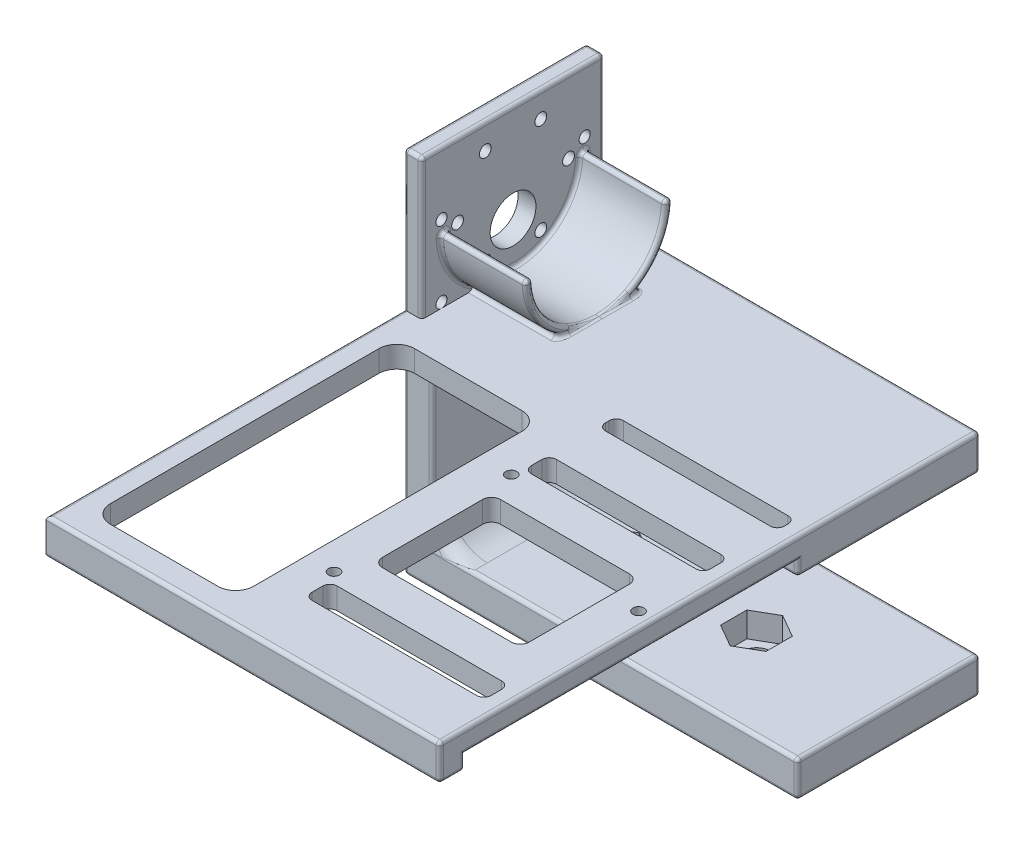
SolidWorks part; units mm, degrees
ref_plane "Front Plane" through (0, 0, 0) normal (0, 0, 1) x (1, 0, 0)
ref_plane "Top Plane" through (0, 0, 0) normal (0, 1, 0) x (1, 0, 0)
ref_plane "Right Plane" through (0, 0, 0) normal (1, 0, 0) x (0, 0, -1)
sketch "Sketch1" plane through (0, 0, 0) normal (0, 0, 1) x (1, 0, 0)
  line L1 (0, 0) -> (8, 0)
  line L2 (0, 0) -> (0, 118)
  line L3 (0, 118) -> (8, 118)
  line L4 (8, 0) -> (8, 118)
  line L5 (4, 118) -> (4, 0) construction
  line L6 (0, 59) -> (8, 59) construction
  line L7 (8, 0) -> (110, 0)
  line L9 (8, 10) -> (110, 10)
  line L10 (110, 0) -> (110, 10)
  line L11 (59, 10) -> (59, 0) construction
  line L12 (3, 5) -> (110, 5) construction
  line L13 (8, 54) -> (110, 54)
  line L15 (8, 64) -> (110, 64)
  line L16 (110, 54) -> (110, 64)
  line L17 (59, 64) -> (59, 54) construction
  line L18 (8, 59) -> (110, 59) construction
  point P99 (59, 5)
  point P128 (59, 59)
  point P236 (4, 59)
extrude "Boss-Extrude1" add sketch "Sketch1" along normal blind 51 contours L13 L16 L15 L4 | L7 L10 L9 L4 | L1 L4 L3 L2
sketch "Sketch2" plane through (8, 0, 0) normal (1, 0, 0) x (0, 0, -1)
  line L0 (-51, 64) -> (0, 64) construction
  line L1 (-51, 64) -> (0, 64) construction
  line L2 (-46, 82.5) -> (-44, 82.5)
  line L3 (-7, 82.5) -> (-5, 82.5)
  arc A0 (-44, 82.5) -> (-7, 82.5) centre (-25.5, 82.5) ccw
  arc A1 (-46, 82.5) -> (-5, 82.5) centre (-25.5, 82.5) ccw
  circle A2 centre (-25.5, 82.5) radius 20.5 construction
  circle A3 centre (-25.5, 82.5) radius 18.5 construction
  point P5 (-25.5, 64)
  dimension "D1" = 37
  dimension "D2" = 2
extrude "Boss-Extrude2" add sketch "Sketch2" along normal blind 21 contours L2 A1 A0 M7
sketch "Sketch3" plane through (0, 0, 0) normal (-1, 0, 0) x (0, 0, 1)
  circle A0 centre (41, 82.5) radius 1.25 construction
  circle A1 centre (33.25, 69.0766) radius 1.25 construction
  circle A2 centre (25.5, 75.5) radius 6 construction
  circle A3 centre (17.75, 69.0766) radius 1.25 construction
  circle A4 centre (10, 82.5) radius 1.25 construction
  circle A5 centre (33.25, 95.9234) radius 1.25 construction
  circle A6 centre (17.75, 95.9234) radius 1.25 construction
  circle A7 centre (41, 82.5) radius 1.25 construction
  circle A8 centre (33.25, 69.0766) radius 1.25 construction
  circle A9 centre (25.5, 75.5) radius 6 construction
  circle A10 centre (17.75, 69.0766) radius 1.25 construction
  circle A11 centre (10, 82.5) radius 1.25 construction
  circle A12 centre (33.25, 95.9234) radius 1.25 construction
  circle A13 centre (17.75, 95.9234) radius 1.25 construction
  circle A14 centre (41, 82.5) radius 1.65
  circle A15 centre (33.25, 69.0766) radius 1.65
  circle A16 centre (25.5, 75.5) radius 6.4
  circle A17 centre (17.75, 69.0766) radius 1.65
  circle A18 centre (10, 82.5) radius 1.65
  circle A19 centre (33.25, 95.9234) radius 1.65
  circle A20 centre (17.75, 95.9234) radius 1.65
  dimension "D1" = 0.4
extrude "Cut-Extrude1" cut sketch "Sketch3" against normal through all
sketch "Sketch4" plane through (0, 10, 0) normal (0, 1, 0) x (1, 0, 0)
  line L1 (39.35, -29.1662) -> (39.35, -21.8338)
  line L2 (39.35, -21.8338) -> (33, -18.1677)
  line L3 (33, -18.1677) -> (26.65, -21.8338)
  line L4 (110, 0) -> (8, 0)
  line L5 (8, 0) -> (8, -51)
  line L6 (8, -51) -> (110, -51)
  line L7 (110, -51) -> (110, 0)
  line L8 (110, 0) -> (8, 0) construction
  line L9 (8, 0) -> (8, -51) construction
  line L10 (8, -51) -> (110, -51) construction
  line L11 (110, -51) -> (110, 0) construction
  line L12 (26.65, -21.8338) -> (26.65, -29.1662)
  line L13 (26.65, -29.1662) -> (33, -32.8323)
  line L14 (33, -32.8323) -> (39.35, -29.1662)
  line L15 (79.35, -29.1662) -> (79.35, -21.8338)
  line L16 (79.35, -21.8338) -> (73, -18.1677)
  line L17 (73, -18.1677) -> (66.65, -21.8338)
  line L18 (66.65, -21.8338) -> (66.65, -29.1662)
  line L19 (66.65, -29.1662) -> (73, -32.8323)
  line L20 (73, -32.8323) -> (79.35, -29.1662)
  circle A0 centre (33, -25.5) radius 6.35 construction
  circle A1 centre (73, -25.5) radius 6.35 construction
  point P21 (8, -25.5)
  dimension "D2" = 40
  dimension "D3" = 25
  dimension "D4" = 12.7
  dimension "D1" = 0
extrude "Cut-Extrude2" cut sketch "Sketch4" against normal blind 6.985
sketch "Sketch5" plane through (0, 3.015, 0) normal (0, 1, 0) x (1, 0, 0)
  line L0 (73, -32.8323) -> (79.35, -29.1662) construction
  line L1 (79.35, -29.1662) -> (79.35, -21.8338) construction
  line L2 (79.35, -21.8338) -> (73, -18.1677) construction
  line L3 (73, -18.1677) -> (66.65, -21.8338) construction
  line L4 (66.65, -21.8338) -> (66.65, -29.1662) construction
  line L5 (66.65, -29.1662) -> (73, -32.8323) construction
  line L6 (33, -32.8323) -> (39.35, -29.1662) construction
  line L7 (39.35, -29.1662) -> (39.35, -21.8338) construction
  line L8 (39.35, -21.8338) -> (33, -18.1677) construction
  line L9 (33, -18.1677) -> (26.65, -21.8338) construction
  line L10 (26.65, -21.8338) -> (26.65, -29.1662) construction
  line L11 (26.65, -29.1662) -> (33, -32.8323) construction
  line L12 (73, -32.8323) -> (79.35, -29.1662) construction
  line L13 (79.35, -29.1662) -> (79.35, -21.8338) construction
  line L14 (79.35, -21.8338) -> (73, -18.1677) construction
  line L15 (73, -18.1677) -> (66.65, -21.8338) construction
  line L16 (66.65, -21.8338) -> (66.65, -29.1662) construction
  line L17 (66.65, -29.1662) -> (73, -32.8323) construction
  line L18 (33, -32.8323) -> (39.35, -29.1662) construction
  line L19 (39.35, -29.1662) -> (39.35, -21.8338) construction
  line L20 (39.35, -21.8338) -> (33, -18.1677) construction
  line L21 (33, -18.1677) -> (26.65, -21.8338) construction
  line L22 (26.65, -21.8338) -> (26.65, -29.1662) construction
  line L23 (26.65, -29.1662) -> (33, -32.8323) construction
  circle A0 centre (33, -25.5) radius 4.064
  circle A1 centre (73, -25.5) radius 4.064
  point P14 (26.65, -25.5)
  point P23 (66.65, -25.5)
  dimension "D1" = 8.128
extrude "Cut-Extrude3" cut sketch "Sketch5" against normal through all
sketch "Sketch6" plane through (8, 0, 0) normal (1, 0, 0) x (0, 0, -1)
  line L0 (0, 64) -> (0, 118) construction
  line L1 (-51, 118) -> (0, 118)
  line L2 (-51, 118) -> (-51, 103)
  line L3 (-51, 103) -> (0, 103)
  line L4 (0, 118) -> (0, 103)
  line L5 (-25.5, 103) -> (-25.5, 118) construction
  line L6 (-51, 110.5) -> (0, 110.5) construction
  line L7 (-51, 64) -> (-34.3318, 64) construction
  point P100 (-25.5, 110.5)
  dimension "D1" = 39
extrude "Cut-Extrude4" cut sketch "Sketch6" against normal through all
fillet "Fillet4" [suppressed] radius 2.5
fillet "Fillet5" [suppressed] radius 0.5
sketch "Sketch7" plane through (0, 0, 51) normal (0, 0, 1) x (1, 0, 0)
  line L0 (8, 64) -> (110, 64) construction
  line L1 (8, 103) -> (5, 103)
  line L2 (8, 103) -> (8, 64)
  line L3 (8, 64) -> (5, 64)
  line L4 (5, 103) -> (5, 64)
  line L5 (6.5, 64) -> (6.5, 103) construction
  line L6 (8, 83.5) -> (5, 83.5) construction
  line L7 (0, 0) -> (0, 103) construction
  point P120 (6.5, 83.5)
  dimension "D1" = 5
extrude "Cut-Extrude5" cut sketch "Sketch7" against normal through all
sketch "Sketch15" plane through (5, 0, 0) normal (1, 0, 0) x (0, 0, -1)
  line L2 (-25.5, 64) -> (-16.6682, 64)
  line L6 (-34.3318, 64) -> (-25.5, 64)
  line L7 (-34.3318, 64) -> (-25.5, 64)
  line L10 (-25.5, 64) -> (-16.6682, 64)
  line L12 (-44, 82.5) -> (-46, 82.5)
  line L13 (-44, 82.5) -> (-46, 82.5)
  line L14 (-5, 82.5) -> (-7, 82.5)
  line L15 (-5, 82.5) -> (-7, 82.5)
  arc A2 (-25.5, 64) -> (-7, 82.5) centre (-25.5, 82.5) ccw
  arc A6 (-46, 82.5) -> (-34.3318, 64) centre (-25.5, 82.5) ccw
  arc A7 (-46, 82.5) -> (-34.3318, 64) centre (-25.5, 82.5) ccw
  arc A10 (-25.5, 64) -> (-7, 82.5) centre (-25.5, 82.5) ccw
  arc A12 (-44, 82.5) -> (-25.5, 64) centre (-25.5, 82.5) ccw
  arc A13 (-44, 82.5) -> (-25.5, 64) centre (-25.5, 82.5) ccw
  arc A14 (-16.6682, 64) -> (-5, 82.5) centre (-25.5, 82.5) ccw
  arc A15 (-16.6682, 64) -> (-5, 82.5) centre (-25.5, 82.5) ccw
  dimension "D1" = 0
  dimension "D2" = 0
extrude "Boss-Extrude3" add sketch "Sketch15" along normal up to surface (3 mm away) contours A13 L13 A7 M10 | A15 L15 A10 M10
sketch "Sketch16" plane through (5, 0, 0) normal (1, 0, 0) x (0, 0, -1)
  line L0 (-51, 64) -> (0, 64) construction
  circle A0 centre (-25.5, 76.5) radius 3.6
  circle A1 centre (-17, 76.5) radius 1.6
  circle A2 centre (-25.5, 68) radius 1.6
  circle A3 centre (-25.5, 82.5) radius 18.5 construction
  circle A4 centre (-25.5, 85) radius 1.6
  circle A5 centre (-34, 76.5) radius 1.6
  point P9 (-25.5, 64)
  point P19 (-25.5, 76.5)
  dimension "D2" = 7.2
  dimension "D4" = 3.2
  dimension "D1" = 12.5
  dimension "D3" = 8.5
  dimension "D5" = 4
extrude "Cut-Extrude6" [suppressed] cut sketch "Sketch16" against normal through all
fillet "Fillet6" radius 1 37 edges at (8, 32, 0) (59, 10, 0) (110, 5, 0) (55, 0, 0) (0, 51.5, 0) (0, 103, 25.5) (2.5, 103, 0) (57.5, 64, 0) (110, 59, 0) (59, 54, 0) (5, 83.5, 0) (5, 103, 25.5) (5, 82.5, 45) (5, 71.5638, 42.8393) (8, 54, 25.5) (5, 64, 25.5) (110, 10, 25.5) (110, 0, 25.5) (0, 0, 25.5) (110, 64, 25.5) (110, 54, 25.5) (5, 82.5, 6) (5, 71.5638, 8.1607) (29, 64, 21.0841) (29, 64, 29.9159) (29, 71.5638, 42.8393) (29, 69.4185, 38.5815) (17, 64, 16.6682) (17, 64, 34.3318) (29, 69.4185, 12.4185) (17, 82.5, 7) (17, 82.5, 46) (29, 82.5, 45) (17, 82.5, 44) (29, 71.5638, 8.1607) (29, 82.5, 6) (17, 82.5, 5)
sketch "Sketch17" [suppressed] plane through (0, 0, 0) normal (-1, 0, 0) x (0, 0, 1)
  circle A0 centre (25.5, 85) radius 2.85
  circle A1 centre (34, 76.5) radius 2.85
  circle A2 centre (25.5, 68) radius 2.85
  circle A3 centre (17, 76.5) radius 2.85
  dimension "D1" = 5.7
extrude "Cut-Extrude7" [suppressed] cut sketch "Sketch17" against normal blind 3
sketch "Sketch18" plane through (0, 0, 51) normal (0, 0, 1) x (1, 0, 0)
  line L0 (109, 64) -> (0, 64)
  line L1 (0, 1) -> (0, 102) construction
  line L2 (109, 54) -> (0, 54)
  line L3 (0, 54) -> (0, 64)
  line L4 (110, 63) -> (110, 55)
  arc A0 (109, 54) -> (110, 55) centre (109, 55) ccw construction
  arc A1 (110, 63) -> (109, 64) centre (109, 63) ccw construction
  arc A2 (109, 54) -> (110, 55) centre (109, 55) ccw
  arc A3 (110, 63) -> (109, 64) centre (109, 63) ccw
extrude "Boss-Extrude4" add sketch "Sketch18" along normal blind 100
sketch "Sketch19" plane through (0, 64, 0) normal (0, 1, 0) x (1, 0, 0)
  line L0 (105.8, -91.24) -> (55, -76) construction
  line L1 (55, -76) -> (53.73, -124.26) construction
  line L2 (53.73, -124.26) -> (105.8, -91.24) construction
  line L3 (0, -151) -> (0, -51) construction
  line L4 (5, -51) -> (0, -51) construction
  line L6 (105.6, -73) -> (55.6, -73)
  line L7 (105.6, -73) -> (105.6, -66)
  line L8 (105.6, -66) -> (55.6, -66)
  line L9 (55.6, -73) -> (55.6, -66)
  line L10 (105.6, -127.26) -> (55.6, -127.26)
  line L11 (105.6, -127.26) -> (105.6, -134.26)
  line L12 (105.6, -134.26) -> (55.6, -134.26)
  line L13 (55.6, -127.26) -> (55.6, -134.26)
  circle A0 centre (55, -76) radius 1.55
  circle A1 centre (53.73, -124.26) radius 1.55
  circle A2 centre (105.8, -91.24) radius 1.55
  point P8 (2.5, -51)
  dimension "D7" = 3.1
  dimension "D1" = 48.26
  dimension "D2" = 1.27
  dimension "D3" = 55
  dimension "D4" = 25
  dimension "D5" = 50.8
  dimension "D6" = 15.24
  dimension "D8" = 7
  dimension "D9" = 0.6
  dimension "D10" = 50
  dimension "D11" = 3
  dimension "D12" = 3
extrude "Cut-Extrude8" cut sketch "Sketch19" against normal up to surface (10 mm away)
sketch "Sketch21" plane through (0, 54, 0) normal (0, -1, 0) x (1, 0, 0)
  line L1 (56.68, 122.5568) -> (56.68, 125.9632)
  line L2 (56.68, 125.9632) -> (53.73, 127.6664)
  line L3 (53.73, 127.6664) -> (50.78, 125.9632)
  line L4 (50.78, 125.9632) -> (50.78, 122.5568)
  line L5 (50.78, 122.5568) -> (53.73, 120.8536)
  line L6 (53.73, 120.8536) -> (56.68, 122.5568)
  line L7 (105.8, 87.8336) -> (108.75, 89.5368)
  line L8 (108.75, 89.5368) -> (108.75, 92.9432)
  line L9 (108.75, 92.9432) -> (105.8, 94.6464)
  line L10 (105.8, 94.6464) -> (102.85, 92.9432)
  line L11 (102.85, 92.9432) -> (102.85, 89.5368)
  line L12 (102.85, 89.5368) -> (105.8, 87.8336)
  line L13 (51.5936, 76) -> (53.2968, 73.05)
  line L14 (53.2968, 73.05) -> (56.7032, 73.05)
  line L15 (56.7032, 73.05) -> (58.4064, 76)
  line L16 (58.4064, 76) -> (56.7032, 78.95)
  line L17 (56.7032, 78.95) -> (53.2968, 78.95)
  line L18 (53.2968, 78.95) -> (51.5936, 76)
  line L19 (55.6, 134.26) -> (55.6, 127.26) construction
  circle A0 centre (53.73, 124.26) radius 2.95 construction
  circle A1 centre (105.8, 91.24) radius 2.95 construction
  circle A2 centre (55, 76) radius 2.95 construction
  dimension "D1" = 5.9
extrude "Cut-Extrude10" cut sketch "Sketch21" against normal blind 7.3
sketch "Sketch20" plane through (0, 54, 0) normal (0, -1, 0) x (1, 0, 0)
  line L0 (105.6, 66) -> (105.6, 73) construction
  line L1 (55.6, 127.26) -> (105.6, 127.26)
  line L2 (55.6, 127.26) -> (55.6, 47.26)
  line L3 (55.6, 47.26) -> (105.6, 47.26)
  line L4 (105.6, 127.26) -> (105.6, 47.26)
  dimension "D1" = 80
extrude "Cut-Extrude9" cut sketch "Sketch20" against normal blind 4
sketch "Sketch22" plane through (0, 58, 0) normal (0, -1, 0) x (1, 0, 0)
  line L0 (105.6, 47.26) -> (105.6, 66) construction
  line L1 (55.6, 47.26) -> (105.6, 47.26)
  line L2 (55.6, 47.26) -> (55.6, 52.26)
  line L3 (55.6, 52.26) -> (105.6, 52.26)
  line L4 (105.6, 47.26) -> (105.6, 52.26)
  dimension "D1" = 5
extrude "Cut-Extrude11" cut sketch "Sketch22" against normal up to surface (6 mm away)
fillet "Fillet7" radius 2 8 edges at (105.6, 61, 66) (105.6, 61, 73) (55.6, 61, 66) (55.6, 61, 73) (55.6, 61, 127.26) (105.6, 61, 127.26) (105.6, 59, 134.26) (55.6, 59, 134.26)
fillet "Fillet8" radius 2 4 edges at (55.6, 59, 47.26) (105.6, 59, 47.26) (105.6, 61, 52.26) (55.6, 61, 52.26)
sketch "Sketch23" plane through (0, 0, 0) normal (-1, 0, 0) x (0, 0, 1)
  line L0 (-27.1184, 75.5) -> (78.1184, 75.5) construction
  circle A1 centre (5.5, 85.5) radius 1.55
  circle A2 centre (45.5, 85.5) radius 1.55
  circle A3 centre (45.5, 65.5) radius 1.55
  circle A4 centre (5.5, 65.5) radius 1.55
  circle A5 centre (25.5, 75.5) radius 6.4 construction
  point P4 (25.5, 75.5)
  dimension "D1" = 3.1
  dimension "D3" = 10
  dimension "D4" = 10
  dimension "D5" = 20
  dimension "D6" = 20
extrude "Cut-Extrude12" cut sketch "Sketch23" against normal up to surface (5 mm away)
sketch "Sketch24" [suppressed] plane through (0, 0, 0) normal (-1, 0, 0) x (0, 0, 1)
  circle A0 centre (5.5, 86.5) radius 3
  circle A1 centre (45.5, 86.5) radius 3
  circle A2 centre (5.5, 66.5) radius 3
  circle A3 centre (45.5, 66.5) radius 3
  dimension "D1" = 6
extrude "Cut-Extrude13" [suppressed] cut sketch "Sketch24" against normal blind 2.3
fillet "Fillet9" radius 1 20 edges at (5, 83, 51) (2.5, 103, 51) (0, 27.5, 51) (55, 0, 51) (0.2929, 0.2929, 51) (0.2929, 102.7071, 51) (4.7071, 102.7071, 51) (8.2929, 53.7071, 51) (109.7071, 9.7071, 50.7071) (109.7071, 0.2929, 50.7071) (0, 83, 51) (0, 64, 101) (0, 54, 101) (109.7071, 54.2929, 151) (110, 59, 151) (109.7071, 63.7071, 151) (54.5, 64, 151) (54.5, 54, 151) (58.5, 10, 51) (8, 31.5, 51)
sketch "Sketch25" plane through (0, 64, 0) normal (0, 1, 0) x (1, 0, 0)
  line L0 (59.5, -86) -> (59.5, -114) construction
  line L3 (62, -86) -> (62, -114)
  line L4 (57, -86) -> (57, -114)
  line L5 (57.6, -73) -> (103.6, -73) construction
  line L7 (0, -151) -> (0, -50) construction
  arc A2 (62, -86) -> (57, -86) centre (59.5, -86) ccw
  arc A3 (57, -114) -> (62, -114) centre (59.5, -114) ccw
  point P2 (59.5, -100)
  dimension "D2" = 2.5
  dimension "D1" = 28
  dimension "D3" = 13
  dimension "D4" = 57
extrude "Cut-Extrude14" cut sketch "Sketch25" against normal through all
pattern_linear "LPattern1" count 4 spacing 12 along (1, 0, 0) of "Cut-Extrude14"
sketch "Sketch26" plane through (0, 64, 0) normal (0, 1, 0) x (1, 0, 0)
  line L0 (0, -151) -> (0, -50) construction
  line L1 (6, -144) -> (46, -144)
  line L2 (6, -144) -> (6, -59)
  line L3 (6, -59) -> (46, -59)
  line L4 (46, -144) -> (46, -59)
  line L5 (1, -150) -> (109, -150) construction
  dimension "D1" = 6
  dimension "D2" = 6
  dimension "D3" = 40
  dimension "D4" = 85
extrude "Cut-Extrude15" cut sketch "Sketch26" against normal through all
fillet "Fillet10" radius 5 4 edges at (6, 59, 144) (46, 59, 144) (46, 59, 59) (6, 59, 59)
sketch "Sketch27" plane through (0, 0, 0) normal (-1, 0, 0) x (0, 0, 1)
  line L0 (144, 54) -> (144, 64) construction
  line L5 (121.9333, 58) -> (78.95, 58) construction
  line L7 (144, 58) -> (51, 58)
  line L8 (144, 58) -> (144, 54)
  line L9 (144, 54) -> (51, 54)
  line L10 (51, 58) -> (51, 54)
  line L11 (97.5, 54) -> (97.5, 58) construction
  line L12 (144, 56) -> (51, 56) construction
  point P424 (97.5, 56)
extrude "Cut-Extrude16" cut sketch "Sketch27" against normal through all
fillet "Fillet11" radius 1 12 edges at (0, 56.5, 144) (0.2929, 54.2929, 144) (110, 56.5, 144) (109.7071, 54.2929, 144) (110, 58, 97.5) (55, 54, 144) (0, 58, 97.5) (0, 56.5, 51) (110, 56.5, 51) (109.7071, 54.2929, 51) (107.3, 54, 51) (31.434, 54, 51)
sketch "Sketch28" plane through (0, 64, 0) normal (0, 1, 0) x (1, 0, 0)
  line L0 (59.5, -83.5) -> (95.5, -83.5)
  line L1 (95.5, -116.5) -> (59.5, -116.5)
  line L2 (98, -114) -> (98, -86) construction
  line L3 (57, -86) -> (57, -114) construction
  line L4 (98, -114) -> (98, -86)
  line L5 (57, -86) -> (57, -114)
  arc A0 (62, -86) -> (57, -86) centre (59.5, -86) ccw construction
  arc A1 (98, -86) -> (93, -86) centre (95.5, -86) ccw construction
  arc A2 (93, -114) -> (98, -114) centre (95.5, -114) ccw construction
  arc A3 (57, -114) -> (62, -114) centre (59.5, -114) ccw construction
  arc A4 (98, -86) -> (95.5, -83.5) centre (95.5, -86) ccw
  arc A5 (95.5, -116.5) -> (98, -114) centre (95.5, -114) ccw
  arc A6 (57, -114) -> (59.5, -116.5) centre (59.5, -114) ccw
  arc A7 (59.5, -83.5) -> (57, -86) centre (59.5, -86) ccw
extrude "Cut-Extrude17" cut sketch "Sketch28" against normal up to next
fillet "Fillet12" radius 11 3 edges at (7.7071, 9.7071, 50.7071) (7.7071, 9.7071, 0.2929) (8, 10, 25.5)
equation "\"D2@Sketch1\"=\"D1@Sketch1\""
